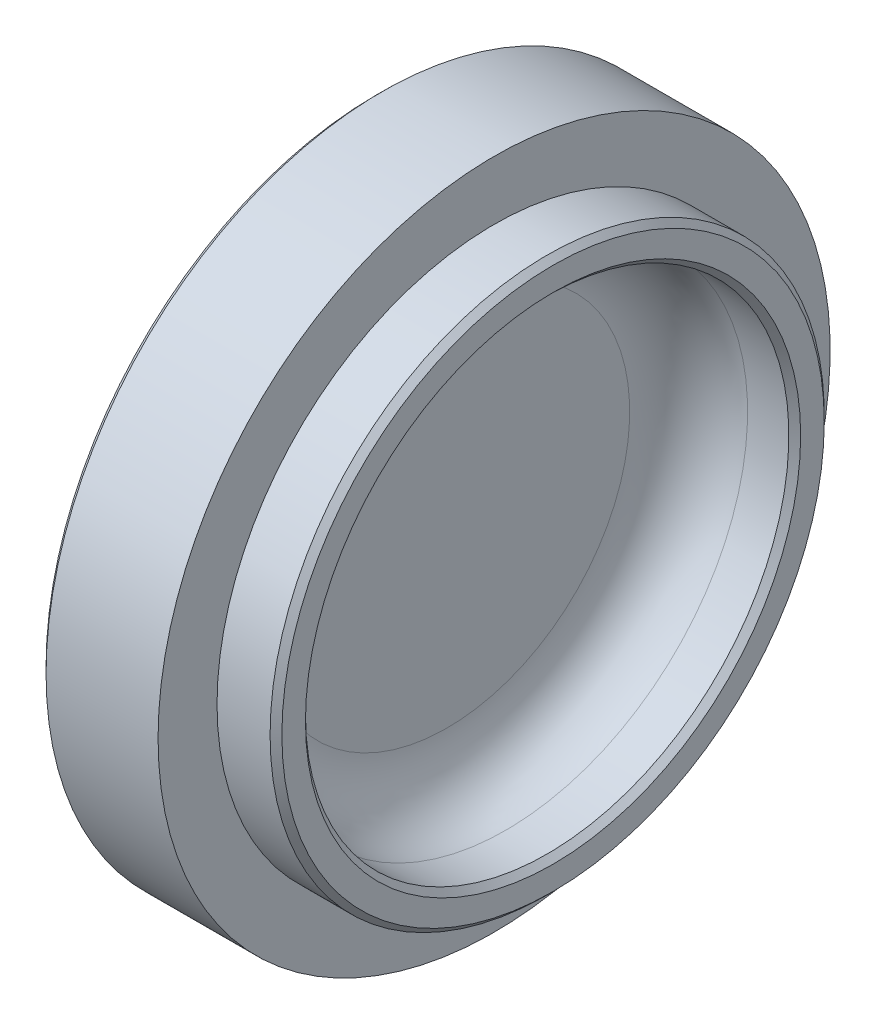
SolidWorks part; units mm, degrees
ref_plane "Plan de face" through (0, 0, 0) normal (0, 0, 1) x (1, 0, 0)
ref_plane "Plan de dessus" through (0, 0, 0) normal (0, 1, 0) x (1, 0, 0)
ref_plane "Plan de droite" through (0, 0, 0) normal (1, 0, 0) x (0, 0, -1)
sketch "Esquisse1" plane through (0, 0, 0) normal (0, 0, 1) x (1, 0, 0)
  line L0 (0, 0) -> (42.1853, 0) construction
  line L1 (0, 0) -> (0, 28.5)
  line L2 (0, 28.5) -> (10, 28.5)
  line L3 (10, 28.5) -> (10, 23.5)
  line L4 (10, 23.5) -> (15, 23.5)
  line L5 (15, 23.5) -> (15, 20.5)
  line L6 (15, 20.5) -> (11, 20.5)
  line L7 (6, 15.5) -> (6, 0)
  line L8 (6, 0) -> (0, 0)
  arc A0 (6, 15.5) -> (11, 20.5) centre (11, 15.5) cw
  dimension "D7" = 5
  dimension "D1" = 47
  dimension "D2" = 3
  dimension "D3" = 10
  dimension "D4" = 28.5
  dimension "D5" = 15
  dimension "D6" = 6
revolve "Révolution1" add sketch "Esquisse1" angle 360 about L0
chamfer "Chanfrein1" distance 0.5 angle 45 3 edges at (15, 0, 23.5) (0, 0, 28.5) (15, 0, 20.5)
